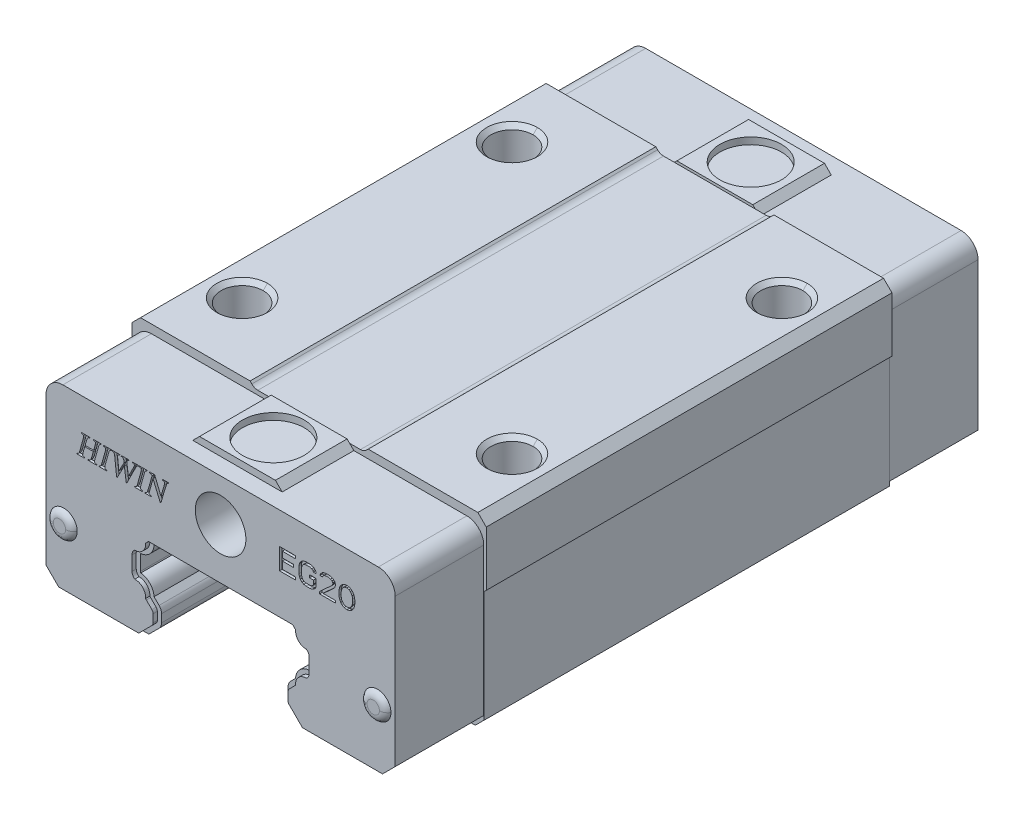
SolidWorks part; units mm, degrees
ref_plane "前视基准面" through (0, 0, 0) normal (0, 0, 1) x (1, 0, 0)
ref_plane "上视基准面" through (0, 0, 0) normal (0, 1, 0) x (1, 0, 0)
ref_plane "右视基准面" through (0, 0, 0) normal (1, 0, 0) x (0, 0, -1)
imported_body "输入1"
sketch "草图1" plane through (0, 0, 58.6) normal (0, 0, 1) x (1, 0, 0)
  line L0 (-7, 12.5) -> (7, 12.5) construction
  line L1 (0, 12.5) -> (0, -15.5) construction
  line L23 (-10, -1.853) -> (-10, -3.547)
  line L24 (-10, -11.1213) -> (-10, -14.5)
  line L25 (8.3896, -0.0554) -> (8.3342, 0)
  line L26 (-9, -15.5) -> (-3, -15.5)
  line L27 (-2.5, -15) -> (2.5, -15)
  line L28 (9, -15.5) -> (10, -14.5)
  line L29 (10, -3.547) -> (10, -1.853)
  line L30 (-10, -14.5) -> (-9, -15.5)
  line L31 (-8.3896, -5.3446) -> (-7.7929, -5.9413)
  line L32 (9.5607, -10.0606) -> (7.7929, -8.2928)
  line L33 (-3, -15.5) -> (3, -15.5) construction
  line L34 (-7.5, -6.6484) -> (-7.5, -7.5857)
  line L35 (10, -14.5) -> (10, -11.1213)
  line L36 (-7.7929, -8.2928) -> (-9.5607, -10.0606)
  line L37 (7.5, -7.5857) -> (7.5, -6.6484)
  line L38 (8.3342, 0) -> (-8.3342, 0)
  line L39 (-8.3342, 0) -> (-8.3896, -0.0554)
  line L40 (2.5, -15) -> (3, -15.5)
  line L41 (7.7929, -5.9413) -> (8.3896, -5.3446)
  line L42 (-3, -15.5) -> (-2.5, -15)
  line L43 (3, -15.5) -> (9, -15.5)
  arc A14 (-7.5, -6.6484) -> (-7.7929, -5.9413) centre (-8.5, -6.6484) ccw
  arc A15 (-9.9603, -1.7039) -> (-8.3896, -0.0554) centre (-10.1371, 0.0371) ccw
  arc A16 (8.3896, -0.0554) -> (9.9603, -1.7039) centre (10.1371, 0.0371) ccw
  arc A17 (-9.5607, -10.0606) -> (-10, -11.1213) centre (-8.5, -11.1213) ccw
  arc A18 (10, -11.1213) -> (9.5607, -10.0606) centre (8.5, -11.1213) ccw
  arc A19 (10, -1.853) -> (9.9603, -1.7039) centre (9.7, -1.853) ccw
  arc A20 (7.5, -7.5857) -> (7.7929, -8.2928) centre (8.5, -7.5857) ccw
  arc A21 (9.9603, -3.6961) -> (10, -3.547) centre (9.7, -3.547) ccw
  arc A22 (-7.7929, -8.2928) -> (-7.5, -7.5857) centre (-8.5, -7.5857) ccw
  arc A23 (7.7929, -5.9413) -> (7.5, -6.6484) centre (8.5, -6.6484) ccw
  arc A24 (9.9603, -3.6961) -> (8.3896, -5.3446) centre (10.1371, -5.4371) ccw
  arc A25 (-9.9603, -1.7039) -> (-10, -1.853) centre (-9.7, -1.853) ccw
  arc A26 (-10, -3.547) -> (-9.9603, -3.6961) centre (-9.7, -3.547) ccw
  arc A27 (-8.3896, -5.3446) -> (-9.9603, -3.6961) centre (-10.1371, -5.4371) ccw
  dimension "D1" = 28
extrude "切除-拉伸1" cut sketch "草图1" against normal through all
sketch "草图2" plane through (0, 0, 48.1) normal (0, 0, 1) x (1, 0, 0)
  line L0 (20.7, 4.7) -> (21, 5) construction
  line L1 (20.7, -8.5) -> (20.71, -8.5)
  line L2 (20.7, -8.5) -> (20.7, 4.71)
  line L3 (20.7, 4.71) -> (20.71, 4.71)
  line L4 (20.71, -8.5) -> (20.71, 4.71)
  dimension "D1" = 0.01
extrude "凸台-拉伸1" add sketch "草图2" against normal up to surface (48.1 mm away)
